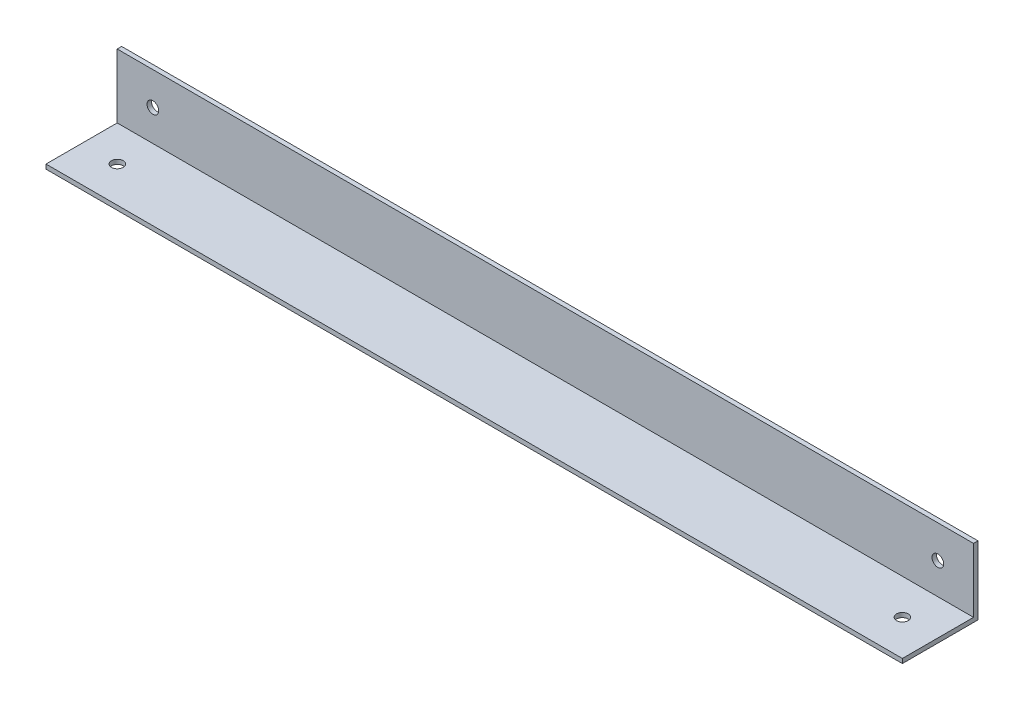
SolidWorks part; units mm, degrees
ref_plane "Front" through (0, 0, 0) normal (0, 0, 1) x (1, 0, 0)
ref_plane "Top" through (0, 0, 0) normal (0, 1, 0) x (1, 0, 0)
ref_plane "Right" through (0, 0, 0) normal (1, 0, 0) x (0, 0, -1)
sketch "Sketch1" plane through (0, 0, 0) normal (0, 0, 1) x (1, 0, 0)
  line L1 (-209.8261, 67.8385) -> (94.9739, 67.8385)
  line L2 (-209.8261, 67.8385) -> (-209.8261, 43.4545)
  line L3 (-209.8261, 43.4545) -> (94.9739, 43.4545)
  line L4 (94.9739, 67.8385) -> (94.9739, 43.4545)
  dimension "D1" = 304.8
  dimension "D2" = 24.384
extrude "Boss-Extrude1" add sketch "Sketch1" along normal blind 26.924
sketch "Sketch2" plane through (0, 67.8385, 0) normal (0, 1, 0) x (1, 0, 0)
  line L0 (-209.8261, -26.924) -> (-209.8261, 0) construction
  line L1 (-209.8261, -1.5875) -> (94.9739, -1.5875)
  line L2 (-209.8261, -1.5875) -> (-209.8261, -26.924)
  line L3 (-209.8261, -26.924) -> (94.9739, -26.924)
  line L4 (94.9739, -1.5875) -> (94.9739, -26.924)
  line L5 (94.9739, 0) -> (-209.8261, 0) construction
  dimension "D1" = 1.5875
extrude "Cut-Extrude1" cut sketch "Sketch2" against normal blind 12.7
sketch "Sketch3" plane through (0, 0, 26.924) normal (0, 0, 1) x (1, 0, 0)
  line L0 (94.9739, 43.4545) -> (94.9739, 55.1385) construction
  line L1 (-209.8261, 55.1385) -> (94.9739, 55.1385)
  line L2 (-209.8261, 55.1385) -> (-209.8261, 45.042)
  line L3 (-209.8261, 45.042) -> (94.9739, 45.042)
  line L4 (94.9739, 55.1385) -> (94.9739, 45.042)
  line L5 (-209.8261, 43.4545) -> (94.9739, 43.4545) construction
  dimension "D1" = 1.5875
extrude "Cut-Extrude3" cut sketch "Sketch3" against normal up to surface (25.3365 mm away)
sketch "Sketch4" plane through (0, 0, 0) normal (0, 0, -1) x (-1, 0, 0)
  line L0 (-94.9739, 43.4545) -> (-94.9739, 67.8385) construction
  line L1 (209.8261, 43.4545) -> (-94.9739, 43.4545) construction
  line L2 (57.4261, 28.0211) -> (57.4261, 119.205) construction
  circle A0 centre (-82.2739, 56.1545) radius 2.0828
  circle A1 centre (197.1261, 56.1545) radius 2.0828
  dimension "D3" = 4.1656
  dimension "D1" = 12.7
  dimension "D2" = 12.7
extrude "Cut-Extrude4" cut sketch "Sketch4" against normal blind 2.54
sketch "Sketch5" plane through (0, 43.4545, 0) normal (0, -1, 0) x (1, 0, 0)
  line L0 (-57.4261, 38.6497) -> (-57.4261, -24.6724) construction
  line L1 (-209.8261, 26.924) -> (-209.8261, 0) construction
  line L2 (-209.8261, 26.924) -> (94.9739, 26.924) construction
  circle A0 centre (-197.1261, 14.224) radius 2.0828
  circle A1 centre (82.2739, 14.224) radius 2.0828
  dimension "D1" = 4.1656
  dimension "D2" = 12.7
  dimension "D3" = 12.7
extrude "Cut-Extrude5" cut sketch "Sketch5" against normal blind 2.54
equation "\".5n\"=1"
